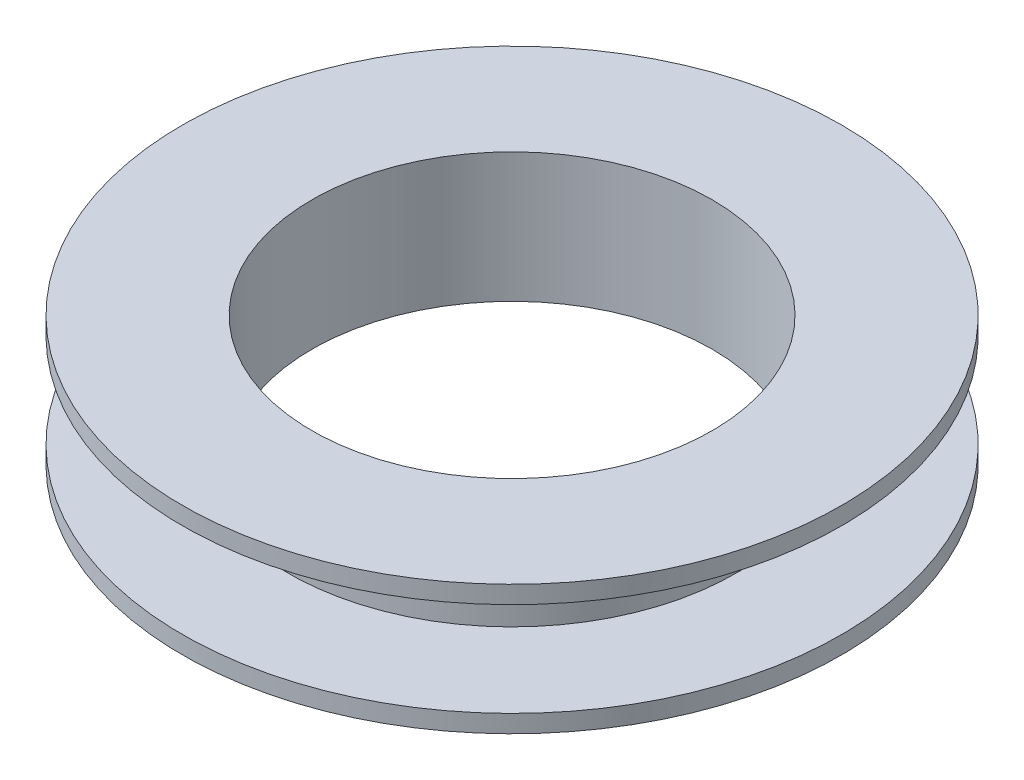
SolidWorks part; units mm, degrees
ref_plane "Front Plane" through (0, 0, 0) normal (0, 0, 1) x (1, 0, 0)
ref_plane "Top Plane" through (0, 0, 0) normal (0, 1, 0) x (1, 0, 0)
ref_plane "Right Plane" through (0, 0, 0) normal (1, 0, 0) x (0, 0, -1)
sketch "Sketch1" plane through (0, 0, 0) normal (0, 0, 1) x (1, 0, 0)
  line L0 (-177.8, 69.85) -> (-177.8, 60.325)
  line L1 (-177.8, 60.325) -> (-120.65, 60.325)
  line L2 (-120.65, 60.325) -> (-120.65, 9.525)
  line L3 (-120.65, 9.525) -> (-177.8, 9.525)
  line L4 (-177.8, 9.525) -> (-177.8, 0)
  line L5 (-177.8, 0) -> (-107.95, 0)
  line L6 (-107.95, 0) -> (-107.95, 69.85)
  line L7 (-107.95, 69.85) -> (-177.8, 69.85)
  line L8 (0, 0) -> (0, 249.0011) construction
  dimension "D1" = 241.3
  dimension "D2" = 50.8
  dimension "D3" = 12.7
  dimension "D4" = 355.6
  dimension "D5" = 9.525
revolve "Revolve1" add sketch "Sketch1" angle 360 about L8
